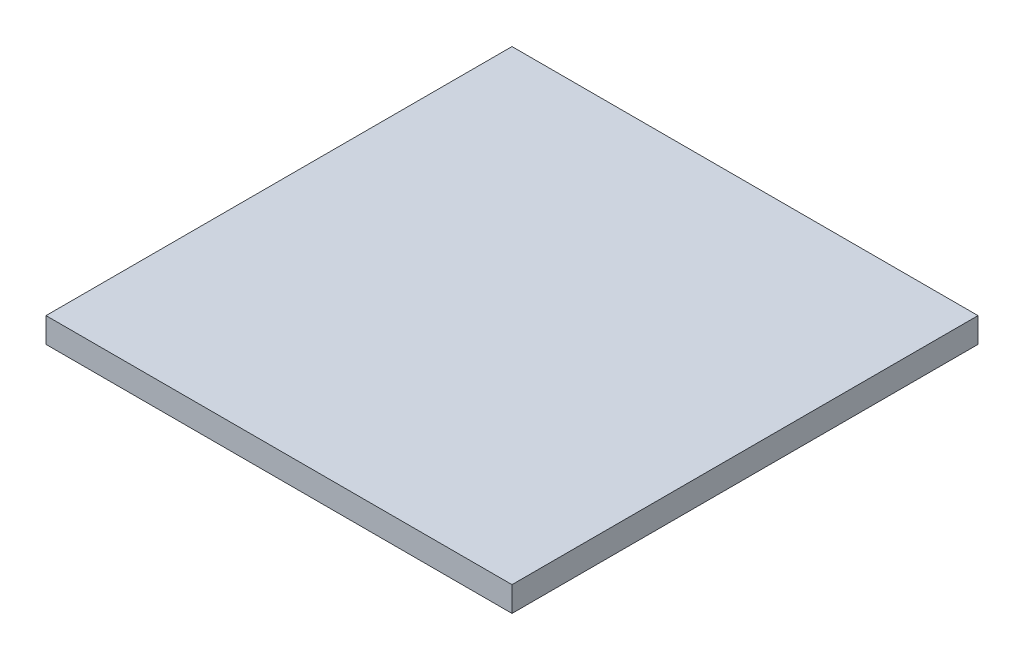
SolidWorks part; units mm, degrees
ref_plane "Front Plane" through (0, 0, 0) normal (0, 0, 1) x (1, 0, 0)
ref_plane "Top Plane" through (0, 0, 0) normal (0, 1, 0) x (1, 0, 0)
ref_plane "Right Plane" through (0, 0, 0) normal (1, 0, 0) x (0, 0, -1)
sketch "Sketch1" plane through (0, 0, 0) normal (0, 1, 0) x (1, 0, 0)
  line L1 (0, 0) -> (88.9, 0)
  line L2 (0, 0) -> (0, 88.9)
  line L3 (0, 88.9) -> (88.9, 88.9)
  line L4 (88.9, 0) -> (88.9, 88.9)
  dimension "D1" = 88.9
  dimension "D2" = 88.9
extrude "Boss-Extrude1" add sketch "Sketch1" along normal blind 4.7625
sketch "Sketch2" plane through (0, 0, 0) normal (0, 0, 1) x (1, 0, 0)
  line L0 (0, 4.7625) -> (88.9, 4.7625) construction
  line L1 (2.54, 4.445) -> (7.62, 4.445)
  line L2 (2.54, 4.445) -> (2.54, 0.3175)
  line L3 (2.54, 0.3175) -> (7.62, 0.3175)
  line L4 (7.62, 4.445) -> (7.62, 0.3175)
  line L5 (0, 0) -> (88.9, 0) construction
  line L8 (0, 4.7625) -> (0, 0) construction
  dimension "D1" = 0.3175
  dimension "D2" = 0.3175
  dimension "D3" = 2.54
  dimension "D4" = 5.08
extrude "Cut-Extrude3" [suppressed] cut sketch "Sketch2" against normal through all
pattern_linear "LPattern1" [suppressed] count 16 spacing 5.3975 count 2 spacing 5.3975
